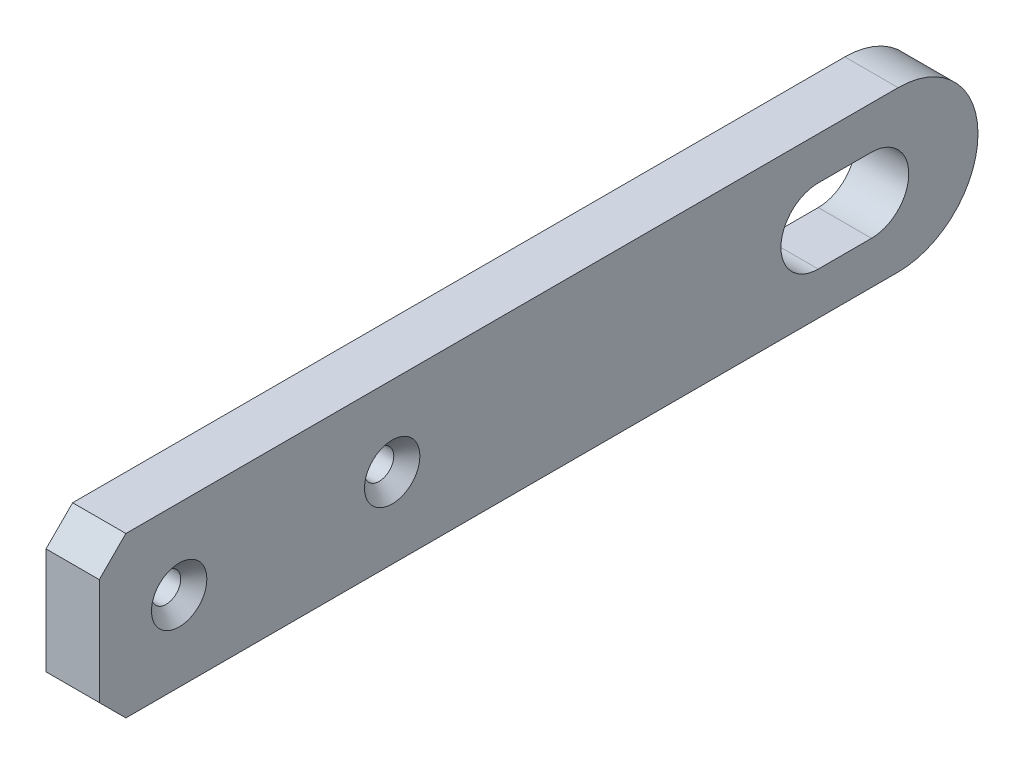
SolidWorks part; units mm, degrees
ref_plane "Alzado" through (0, 0, 0) normal (0, 0, 1) x (1, 0, 0)
ref_plane "Planta" through (0, 0, 0) normal (0, 1, 0) x (1, 0, 0)
ref_plane "Vista lateral" through (0, 0, 0) normal (1, 0, 0) x (0, 0, -1)
ref_plane "Plano1" through (6, 0, 0) normal (1, 0, 0) x (0, 0, -1)
sketch "Croquis1" plane through (6, 0, 0) normal (1, 0, 0) x (0, 0, -1)
  line L0 (332.3157, 2.7405) -> (182.3157, 2.7405)
  line L1 (182.3157, 2.7405) -> (182.3157, -27.2595)
  line L2 (182.3157, -27.2595) -> (332.3157, -27.2595)
  arc A0 (332.3157, -27.2595) -> (332.3157, 2.7405) centre (332.3157, -12.2595) ccw
  point P5 (0, 0)
  dimension "D1" = 150
  dimension "D2" = 30
extrude "Saliente-Extruir1" add sketch "Croquis1" against normal blind 10
sketch "Croquis2" plane through (-4, 0, 0) normal (-1, 0, 0) x (0, 0, 1)
  line L0 (-327.3157, -19.2595) -> (-317.3157, -19.2595)
  line L1 (-317.3157, -5.2595) -> (-327.3157, -5.2595)
  line L4 (-332.3157, 2.7405) -> (-182.3157, 2.7405) construction
  arc A0 (-317.3157, -19.2595) -> (-317.3157, -5.2595) centre (-317.3157, -12.2595) ccw
  arc A1 (-327.3157, -5.2595) -> (-327.3157, -19.2595) centre (-327.3157, -12.2595) ccw
  arc A2 (-332.3157, 2.7405) -> (-332.3157, -27.2595) centre (-332.3157, -12.2595) ccw construction
  dimension "D4" = 7
  dimension "D1" = 15
  dimension "D2" = 5
  dimension "D3" = 10
extrude "Cortar-Extruir1" cut sketch "Croquis2" against normal through all
ref_plane "Plano2" through (0, 0, -252.5) normal (0, 0, -1) x (-1, 0, 0)
ref_plane "Plano3" through (0, 0, -302.7583) normal (0, 0, 1) x (1, 0, 0)
hole_wizard "Diámetro de taladro Ø4.1 (4.1)1" positions "Croquis5" profile "Croquis4" hole size "Ø4.1" standard "Ansi Metric"
sketch "Croquis5" plane through (0, 0, -302.7583) normal (0, 0, 1) x (1, 0, 0)
  point P0 (3, -5.5)
sketch "Croquis4" plane through (3, -5.5, -302.7583) normal (1, 0, 0) x (0, -1, 0)
  line L0 (0, 0) -> (0, 44.5574)
  line L1 (0, 44.5574) -> (2.05, 44.5574)
  line L2 (2.05, 44.5574) -> (2.05, 0)
  line L5 (2.05, 0) -> (0, 0)
  line L11 (0, -6.35) -> (0, 107.95) construction
  dimension "Diámetro de taladro hasta el siguiente" = 4.1
  dimension "Profundidad de taladro hasta el siguiente" = 44.5574
hole_wizard "Avellanado para tornillo con cabeza plana de M51" positions "Croquis7" profile "Croquis6" countersink size "M5" standard "Ansi Metric"
sketch "Croquis7" plane through (6, 0, 0) normal (1, 0, 0) x (0, 0, -1)
  line L0 (182.3157, 2.7405) -> (182.3157, -27.2595) construction
  line L1 (332.3157, 2.7405) -> (182.3157, 2.7405) construction
  point P0 (197.3157, -12.2595)
  point P9 (237.3157, -12.2595)
  dimension "D1" = 15
  dimension "D2" = 15
  dimension "D4" = 40
  dimension "D3" = 2
sketch "Croquis6" plane through (6, -12.2595, -197.3157) normal (0, 1, 0) x (0, 0, -1)
  line L0 (0, 0) -> (0, 10)
  line L1 (0, 10) -> (2.75, 10)
  line L2 (2.75, 10) -> (2.75, 2.45)
  line L3 (2.75, 2.45) -> (5.2, 0)
  line L5 (5.2, 0) -> (0, 0)
  line L6 (-2.75, 2.45) -> (-5.2, 0) construction
  line L11 (0, -6.35) -> (0, 107.95) construction
  dimension "Diámetro de taladro hasta el siguiente" = 5.5
  dimension "Profundidad de taladro hasta el siguiente" = 10
  dimension "Diámetro de avellanado cercano" = 10.4
  dimension "Ángulo de avellanado cercano" = 90
ref_plane "Plano4" through (0, 0, -268.2417) normal (0, 0, -1) x (-1, 0, 0)
chamfer "Chaflán1" distance 5 angle 45 2 edges at (1, 2.7405, -182.3157) (1, -27.2595, -182.3157)
